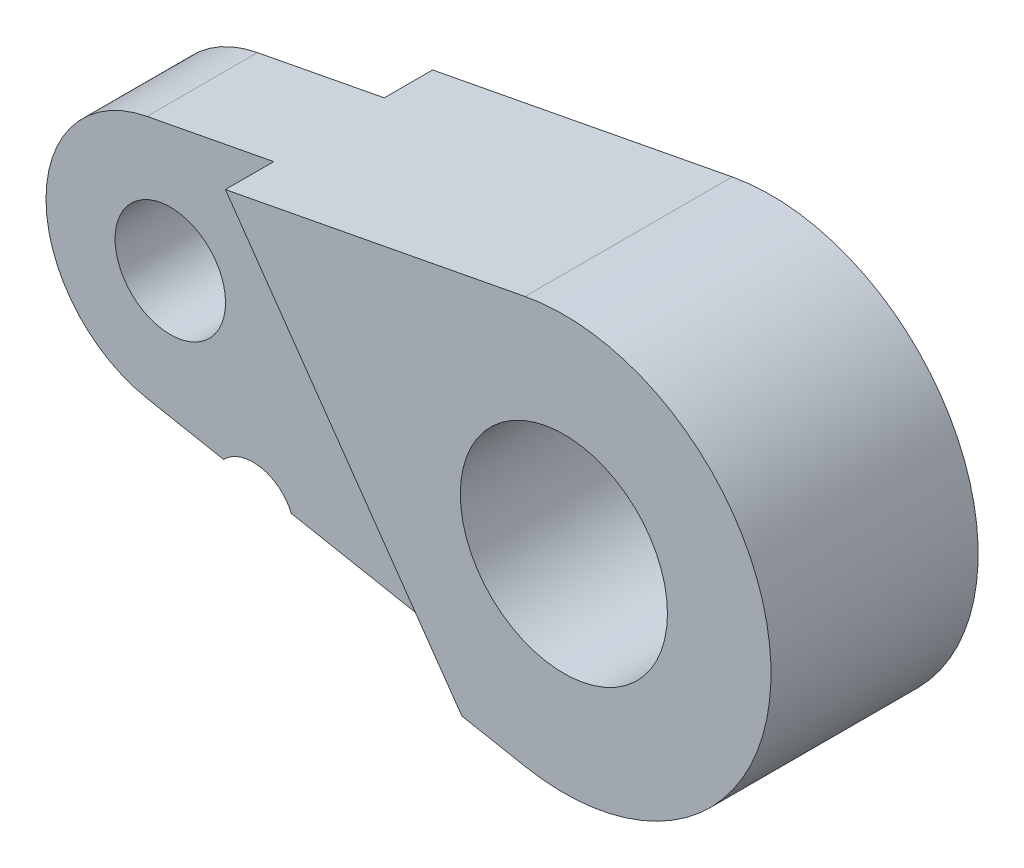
SolidWorks part; units mm, degrees
ref_plane "Plan1" through (0, 0, 0) normal (0, 0, 1) x (1, 0, 0)
ref_plane "Plan2" through (0, 0, 0) normal (0, 1, 0) x (1, 0, 0)
ref_plane "Plan3" through (0, 0, 0) normal (1, 0, 0) x (0, 0, -1)
sketch "Esquisse1" plane through (0, 0, 0) normal (0, 0, 1) x (1, 0, 0)
  line L0 (-33.6875, 8.8404) -> (-2.8125, 14.734)
  line L1 (-33.6875, -8.8404) -> (-2.8125, -14.734)
  arc A0 (-2.8125, -14.734) -> (-2.8125, 14.734) centre (0, 0) ccw
  arc A1 (-33.6875, 8.8404) -> (-33.6875, -8.8404) centre (-32, 0) ccw
  dimension "D2" = 9
  dimension "D3" = 15
  dimension "D1" = 32
extrude "Extrusion1" add sketch "Esquisse1" along normal mid plane 15
sketch "Esquisse2" plane through (0, 0, 7.5) normal (0, 0, 1) x (1, 0, 0)
  line L0 (-24.5079, 10.5926) -> (-33.6875, 8.8404)
  line L1 (-2.8125, 14.734) -> (-33.6875, 8.8404) construction
  line L2 (-33.6875, -8.8404) -> (-7.3852, -13.8611)
  line L3 (-33.6875, -8.8404) -> (-2.8125, -14.734) construction
  line L4 (-7.3852, -13.8611) -> (-24.5079, 10.5926)
  line L5 (-32, 0) -> (0, 0) construction
  arc A0 (-33.6875, 8.8404) -> (-33.6875, -8.8404) centre (-32, 0) ccw
  dimension "D1" = 14
  dimension "D2" = 55
extrude "Enlèv. mat.-Extru.1" cut sketch "Esquisse2" against normal blind 3.5
mirror "Symétrie1" about plane through (0, 0, 0) normal (0, 0, 1) of "Enlèv. mat.-Extru.1"
sketch "Esquisse3" plane through (0, 0, 7.5) normal (0, 0, 1) x (1, 0, 0)
  circle A0 centre (0, 0) radius 7.5
  circle A1 centre (-32, 0) radius 4
  arc A2 (-33.6875, 8.8404) -> (-33.6875, -8.8404) centre (-32, 0) ccw construction
  dimension "D1" = 8
  dimension "D2" = 15
extrude "Enlèv. mat.-Extru.2" cut sketch "Esquisse3" against normal through all
sketch "Esquisse4" plane through (0, 0, 0) normal (0, 0, 1) x (1, 0, 0)
  circle A0 centre (-26, -12) radius 3
  circle A1 centre (-32, 0) radius 4 construction
  dimension "D1" = 12
  dimension "D2" = 6
  dimension "D3" = 6
extrude "Enlèv. mat.-Extru.3" cut sketch "Esquisse4" against normal through all and the other way through all
